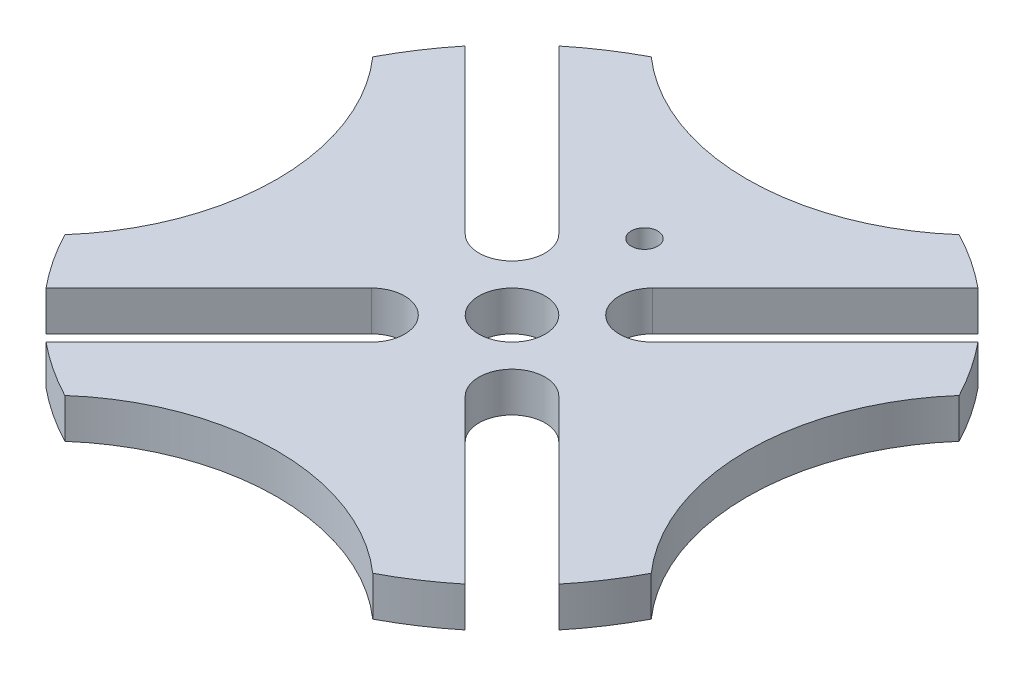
SolidWorks part; units mm, degrees
ref_plane "正面" through (0, 0, 0) normal (0, 0, 1) x (1, 0, 0)
ref_plane "平面" through (0, 0, 0) normal (0, 1, 0) x (1, 0, 0)
ref_plane "右側面" through (0, 0, 0) normal (1, 0, 0) x (0, 0, -1)
sketch "ｽｹｯﾁ1" plane through (0, 0, 0) normal (0, 1, 0) x (1, 0, 0)
  circle A0 centre (0, 0) radius 50
  dimension "D1" = 100
extrude "押し出し1" add sketch "ｽｹｯﾁ1" along normal blind 6
sketch "ｽｹｯﾁ2" plane through (0, 6, 0) normal (0, 1, 0) x (1, 0, 0)
  line L0 (0, 0) -> (-50, 0) construction
  line L1 (0, 0) -> (-35.3553, 35.3553) construction
  line L2 (-7.0711, 14.1421) -> (-31.6426, 38.7137)
  line L3 (-38.7137, 31.6426) -> (-14.1421, 7.0711)
  circle A0 centre (0, 0) radius 50 construction
  arc A1 (-14.1421, 7.0711) -> (-7.0711, 14.1421) centre (-10.6066, 10.6066) ccw
  arc A2 (-31.6426, 38.7137) -> (-38.7137, 31.6426) centre (0, 0) ccw
  dimension "D1" = 45
  dimension "D2" = 10
  dimension "D3" = 15
extrude "ｶｯﾄ - 押し出し1" cut sketch "ｽｹｯﾁ2" against normal through all
sketch "ｽｹｯﾁ3" plane through (0, 6, 0) normal (0, 1, 0) x (1, 0, 0)
  line L0 (0, 0) -> (-70.7, 0) construction
  circle A0 centre (-70.7, 0) radius 35.2
  dimension "D2" = 35.2
  dimension "D1" = 70.7
extrude "ｶｯﾄ - 押し出し2" cut sketch "ｽｹｯﾁ3" against normal through all
pattern_circular "円形ﾊﾟﾀｰﾝ1" count 4 over 360 about axis through (0, 0, 0) along (0, 1, 0) of "ｶｯﾄ - 押し出し2", "ｶｯﾄ - 押し出し1"
sketch "ｽｹｯﾁ4" plane through (0, 6, 0) normal (0, 1, 0) x (1, 0, 0)
  circle A0 centre (0, 0) radius 5
  dimension "D1" = 10
extrude "ｶｯﾄ - 押し出し3" cut sketch "ｽｹｯﾁ4" against normal through all
sketch "ｽｹｯﾁ5" plane through (0, 6, 0) normal (0, 1, 0) x (1, 0, 0)
  line L0 (0, 20) -> (0, 0) construction
  circle A0 centre (0, 20) radius 2
  dimension "D1" = 4
  dimension "D2" = 20
extrude "ｶｯﾄ - 押し出し4" cut sketch "ｽｹｯﾁ5" against normal through all
